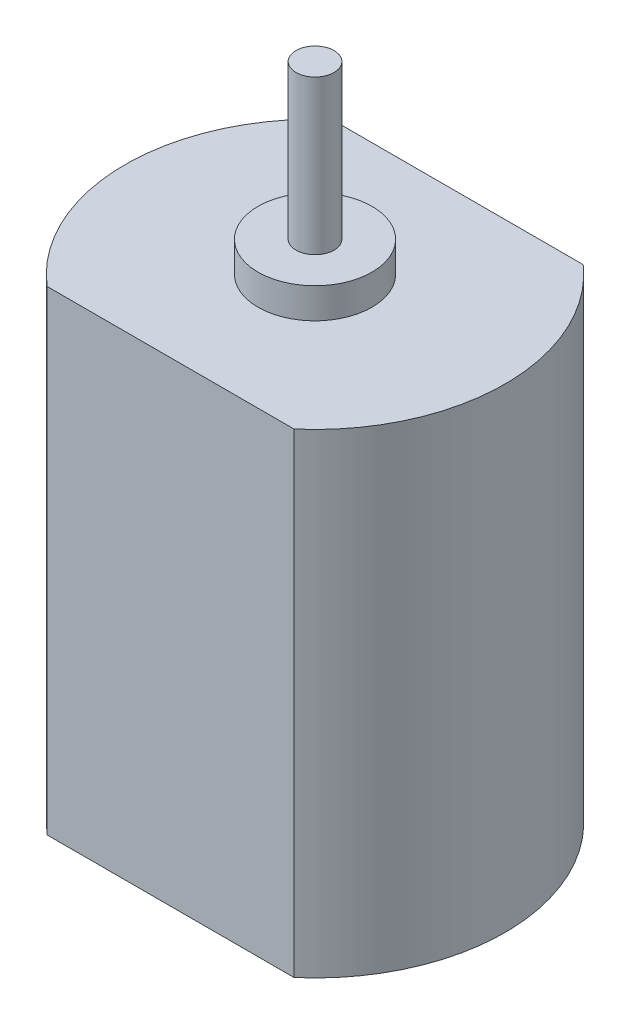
SolidWorks part; units mm, degrees
ref_plane "Front Plane" through (0, 0, 0) normal (0, 0, 1) x (1, 0, 0)
ref_plane "Top Plane" through (0, 0, 0) normal (0, 1, 0) x (1, 0, 0)
ref_plane "Right Plane" through (0, 0, 0) normal (1, 0, 0) x (0, 0, -1)
sketch "Sketch3" plane through (0, 0, 0) normal (0, 1, 0) x (1, 0, 0)
  line L0 (-6.6159, 7.4986) -> (6.6159, 7.4986)
  line L1 (-6.4976, -7.6014) -> (6.4976, -7.6014)
  arc A0 (-6.6159, 7.4986) -> (-6.4976, -7.6014) centre (0, 0) ccw
  arc A1 (6.4976, -7.6014) -> (6.6159, 7.4986) centre (0, 0) ccw
  dimension "D1" = 20
  dimension "D2" = 15.1
extrude "Boss-Extrude3" add sketch "Sketch3" along normal blind 25
sketch "Sketch4" plane through (0, 25, 0) normal (0, 1, 0) x (1, 0, 0)
  circle A0 centre (0, 0) radius 1
  dimension "D1" = 2
extrude "Boss-Extrude4" add sketch "Sketch4" along normal blind 9.7
sketch "Sketch5" plane through (0, 25, 0) normal (0, 1, 0) x (1, 0, 0)
  circle A0 centre (0, 0) radius 3
  dimension "D1" = 6
extrude "Boss-Extrude5" add sketch "Sketch5" along normal blind 1.6
